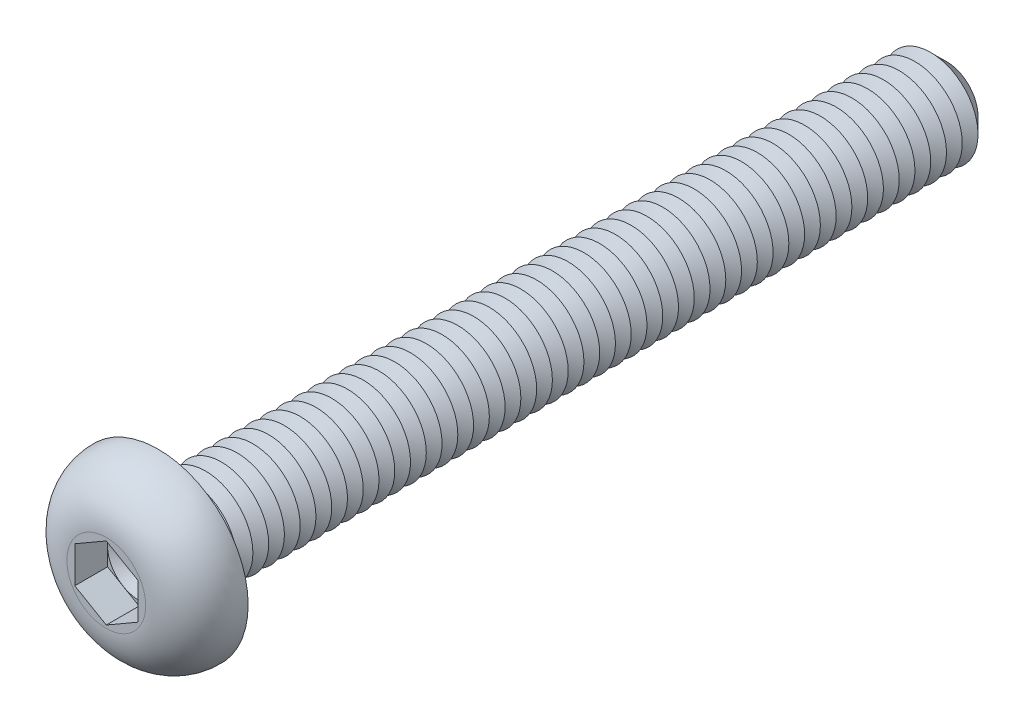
SolidWorks part; units mm, degrees
ref_plane "Front Plane" through (0, 0, 0) normal (0, 0, 1) x (1, 0, 0)
ref_plane "Top Plane" through (0, 0, 0) normal (0, 1, 0) x (1, 0, 0)
ref_plane "Right Plane" through (0, 0, 0) normal (1, 0, 0) x (0, 0, -1)
sketch "Sketch1" plane through (0, 0, 0) normal (1, 0, 0) x (0, 0, -1)
  line L0 (-47.9342, 0) -> (60.3146, 0) construction
sketch "Sketch2" plane through (0, 0, 0) normal (1, 0, 0) x (0, 0, -1)
  line L0 (0, 0) -> (-1.65, 0)
  line L1 (-47.9342, 0) -> (60.3146, 0) construction
  line L2 (-1.65, 0) -> (-1.65, 1.2508)
  line L3 (0, 2.85) -> (0, 0)
  arc A0 (-1.65, 1.2508) -> (0, 2.85) centre (-0.05, 1.2508) cw
  dimension "D1" = 1.6
  dimension "D2" = 1.65
  dimension "D3" = 2.85
revolve "Revolve1" add sketch "Sketch2" angle 360 about L0
sketch "Sketch3" plane through (0, 0, 1.65) normal (0, 0, 1) x (1, 0, 0)
  line L1 (0, 1.1547) -> (-1, 0.5774)
  line L2 (-1, 0.5774) -> (-1, -0.5774)
  line L3 (-1, -0.5774) -> (0, -1.1547)
  line L4 (0, -1.1547) -> (1, -0.5774)
  line L5 (1, -0.5774) -> (1, 0.5774)
  line L6 (1, 0.5774) -> (0, 1.1547)
  circle A0 centre (0, 0) radius 1 construction
  dimension "D1" = 2
extrude "Cut-Extrude1" cut sketch "Sketch3" against normal blind 1.04
sketch "Sketch4" plane through (0, 0, 0) normal (0, 0, -1) x (-1, 0, 0)
  circle A0 centre (0, 0) radius 1.5
  dimension "D1" = 3
extrude "Boss-Extrude1" add sketch "Sketch4" along normal blind 25
chamfer "Chamfer1" distance 0.5 angle 45 1 edges at (-1.5, 0, -25)
sketch "Sketch5" plane through (0, 0, 0) normal (1, 0, 0) x (0, 0, -1)
  line L0 (0.5, 1.5) -> (1, 1.5)
  line L1 (24.5, 1.5) -> (0, 1.5) construction
  line L2 (1, 1.5) -> (0.75, 1.067)
  line L3 (0.75, 1.067) -> (0.5, 1.5)
  line L4 (0, -2.85) -> (0, 2.85) construction
  line L5 (24.5, 1.5) -> (0, 1.5) construction
  dimension "D1" = 0.5
  dimension "D2" = 0.5
revolve "Cut-Revolve1" cut sketch "Sketch5" angle 360 about L0
pattern_linear "LPattern1" count 48 spacing 0.5 along (0, 0, -1) of "Cut-Revolve1"
fillet "Fillet2" radius 0.2 1 edges at (1.5, 0, 0)
sketch "Sketch6" plane through (0, 0, 0.61) normal (0, 0, 1) x (1, 0, 0)
  line L0 (0, -1.1547) -> (1, -0.5774) construction
  circle A0 centre (0, 0) radius 1
extrude "Cut-Extrude2" cut sketch "Sketch6" against normal through all draft 60
